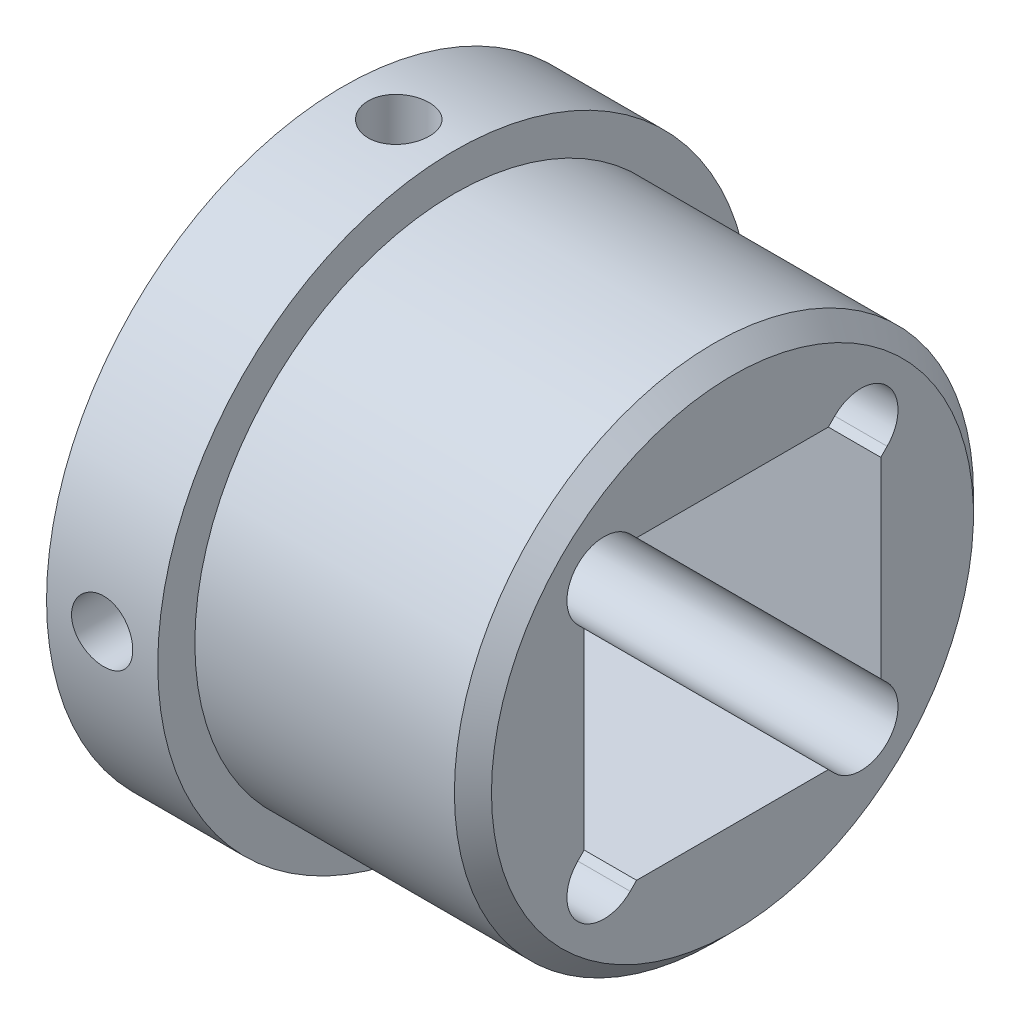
SolidWorks part; units mm, degrees
ref_plane "Plan de face" through (0, 0, 0) normal (0, 0, 1) x (1, 0, 0)
ref_plane "Plan de dessus" through (0, 0, 0) normal (0, 1, 0) x (1, 0, 0)
ref_plane "Plan de droite" through (0, 0, 0) normal (1, 0, 0) x (0, 0, -1)
sketch "Esquisse1" plane through (0, 0, 0) normal (0, 0, 1) x (1, 0, 0)
  line L0 (-19.0972, 0) -> (8.7608, 0) construction
  line L2 (0, 0) -> (21, 0)
  line L3 (0, 0) -> (0, 16)
  line L4 (0, 16) -> (6, 16)
  line L5 (21, 0) -> (21, 14)
  line L8 (21, 14) -> (6, 14)
  line L9 (6, 16) -> (6, 14)
  dimension "D1" = 6
  dimension "D2" = 15
  dimension "D3" = 16
  dimension "D4" = 14
revolve "Révolution1" add sketch "Esquisse1" angle 360 about L0
sketch "Esquisse2" plane through (21, 0, 0) normal (1, 0, 0) x (0, 0, -1)
  line L0 (-12.0208, 12.0208) -> (0, 0) construction
  line L1 (-8, 8) -> (8, 8)
  line L2 (-8, 8) -> (-8, -8)
  line L3 (-8, -8) -> (8, -8)
  line L4 (8, 8) -> (8, -8)
  line L5 (0, 0) -> (-30.1216, 0) construction
  dimension "D1" = 16
  dimension "D2" = 16
  dimension "D3" = 8
  dimension "D4" = 8
  dimension "D5" = 17
  dimension "D7" = 45
extrude "Enlèv. mat.-Extru.1" cut sketch "Esquisse2" against normal through all
chamfer "Chanfrein1" distance 1 angle 45 1 edges at (21, 0, 14)
hole_wizard "Trou taraudé M41" positions "Esquisse5" profile "Esquisse4" tap size "M4" standard "ISO"
sketch "Esquisse5" plane through (0, 8, 0) normal (0, -1, 0) x (1, 0, 0)
  line L0 (6, 0) -> (0, 0) construction
  line L1 (0, 16) -> (0, -16) construction
  point P0 (3, 0)
  dimension "D1" = 3
sketch "Esquisse4" plane through (3, 8, 0) normal (1, 0, 0) x (0, 0, -1)
  line L0 (0, 0) -> (0, 12.4914)
  line L1 (0, 12.4914) -> (1.65, 11.5)
  line L2 (1.65, 11.5) -> (1.65, 0)
  line L5 (1.65, 0) -> (0, 0)
  line L10 (0, 12.4914) -> (-1.65, 11.5) construction
  line L11 (0, -6.35) -> (0, 107.95) construction
  dimension "Diamètre du trou pour taraudage" = 3.3
  dimension "Profondeur du trou pour taraudage" = 11.5
  dimension "Angle de pointe" = 118
pattern_circular "Répétition circulaire1" count 4 over 360 about axis through (-19.0972, 0, 0) along (-1, 0, 0) of "Trou taraudé M41"
sketch "Esquisse6" plane through (21, 0, 0) normal (1, 0, 0) x (0, 0, -1)
  line L0 (0, 0) -> (6.9296, 6.9296) construction
  line L1 (8.3439, 5.5154) -> (4.9874, 8.8719) construction
  line L2 (5.5154, 8.3439) -> (5.1716, 8)
  line L3 (8, 8) -> (-8, 8) construction
  line L4 (8.3439, 5.5154) -> (8, 5.1716)
  line L5 (8, -8) -> (8, 8) construction
  line L6 (5.1716, 8) -> (8, 5.1716)
  arc A0 (8.3439, 5.5154) -> (5.5154, 8.3439) centre (6.9296, 6.9296) ccw
  dimension "D2" = 4
  dimension "D1" = 9.8
extrude "Enlèv. mat.-Extru.2" cut sketch "Esquisse6" against normal through all
pattern_circular "Répétition circulaire2" count 4 over 360 about axis through (0, 0, 0) along (1, 0, 0) of "Enlèv. mat.-Extru.2"
